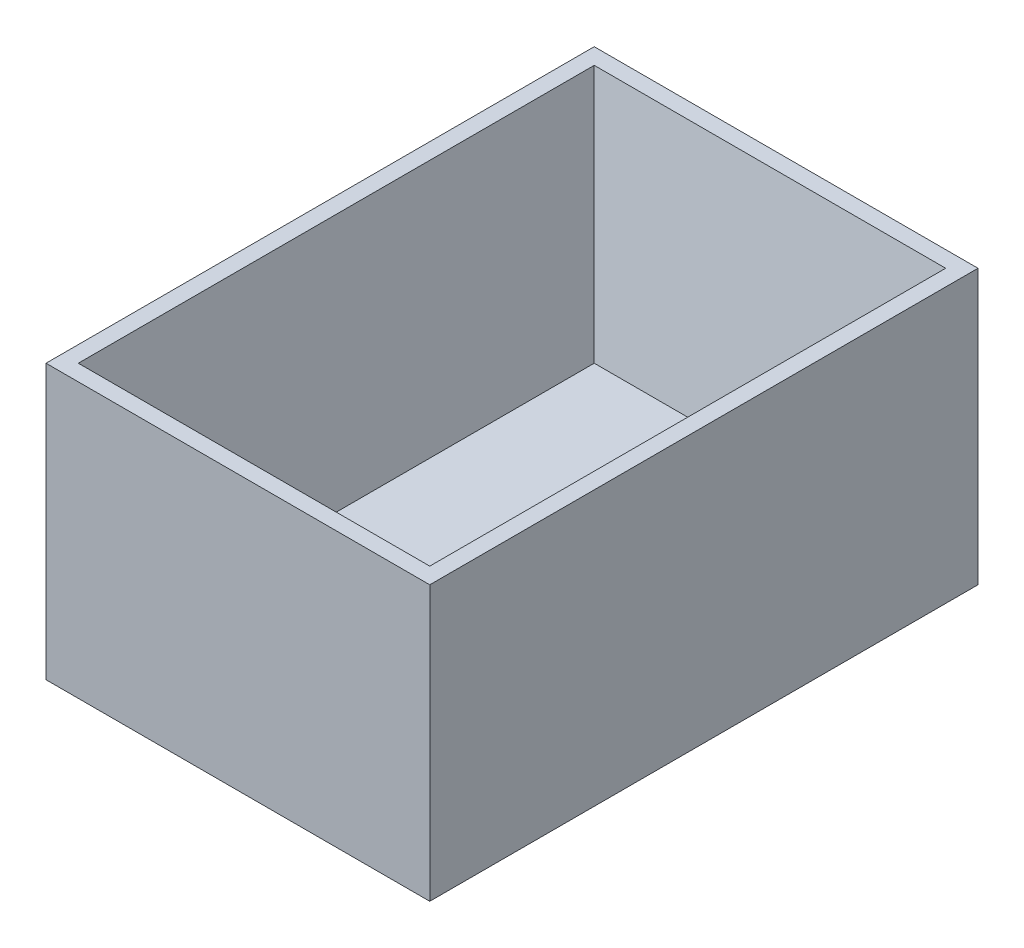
SolidWorks part; units mm, degrees
ref_plane "Plan de face" through (0, 0, 0) normal (0, 0, 1) x (1, 0, 0)
ref_plane "Plan de dessus" through (0, 0, 0) normal (0, 1, 0) x (1, 0, 0)
ref_plane "Plan de droite" through (0, 0, 0) normal (1, 0, 0) x (0, 0, -1)
sketch "Esquisse1" plane through (0, 0, 0) normal (0, 1, 0) x (1, 0, 0)
  line L1 (0, 0) -> (70, 0)
  line L2 (0, 0) -> (0, -100)
  line L3 (0, -100) -> (70, -100)
  line L4 (70, 0) -> (70, -100)
  dimension "D1" = 100
  dimension "D2" = 70
extrude "Boss.-Extru.1" add sketch "Esquisse1" along normal blind 50
sketch "Esquisse2" plane through (0, 50, 0) normal (0, 1, 0) x (1, 0, 0)
  line L0 (0, 0) -> (0, -100) construction
  line L1 (10, -10) -> (60, -10)
  line L2 (10, -10) -> (10, -90)
  line L3 (10, -90) -> (60, -90)
  line L4 (60, -10) -> (60, -90)
  line L5 (70, -100) -> (70, 0) construction
  line L6 (70, 0) -> (0, 0) construction
  line L7 (0, -100) -> (70, -100) construction
  dimension "D1" = 10
  dimension "D2" = 10
  dimension "D3" = 10
  dimension "D4" = 10
extrude "Enlèv. mat.-Extru.1" cut sketch "Esquisse2" against normal blind 40
draft "Dépouille1" draft angle 10 faces to draft 4 parameters "D1"=10
